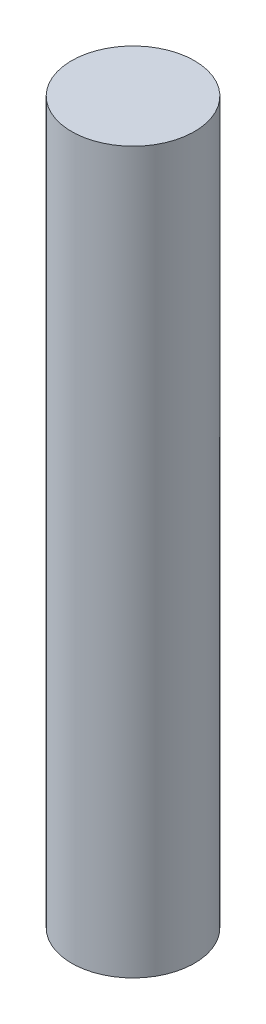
SolidWorks part; units mm, degrees
ref_plane "Alzado" through (0, 0, 0) normal (0, 0, 1) x (1, 0, 0)
ref_plane "Planta" through (0, 0, 0) normal (0, 1, 0) x (1, 0, 0)
ref_plane "Vista lateral" through (0, 0, 0) normal (1, 0, 0) x (0, 0, -1)
sketch "Croquis3" plane through (0, 0, 0) normal (0, 0, 1) x (1, 0, 0)
  line L0 (0, 0) -> (0, 17.59) construction
  line L1 (0, 17.59) -> (1.5, 17.59)
  line L2 (1.5, 17.59) -> (1.5, 0)
  line L3 (1.5, 0) -> (0, 0)
  line L4 (0, 0) -> (0, 17.59)
  dimension "D1" = 17.59
  dimension "D2" = 1.5
revolve "Revolución2" add sketch "Croquis3" angle 360 about L0
